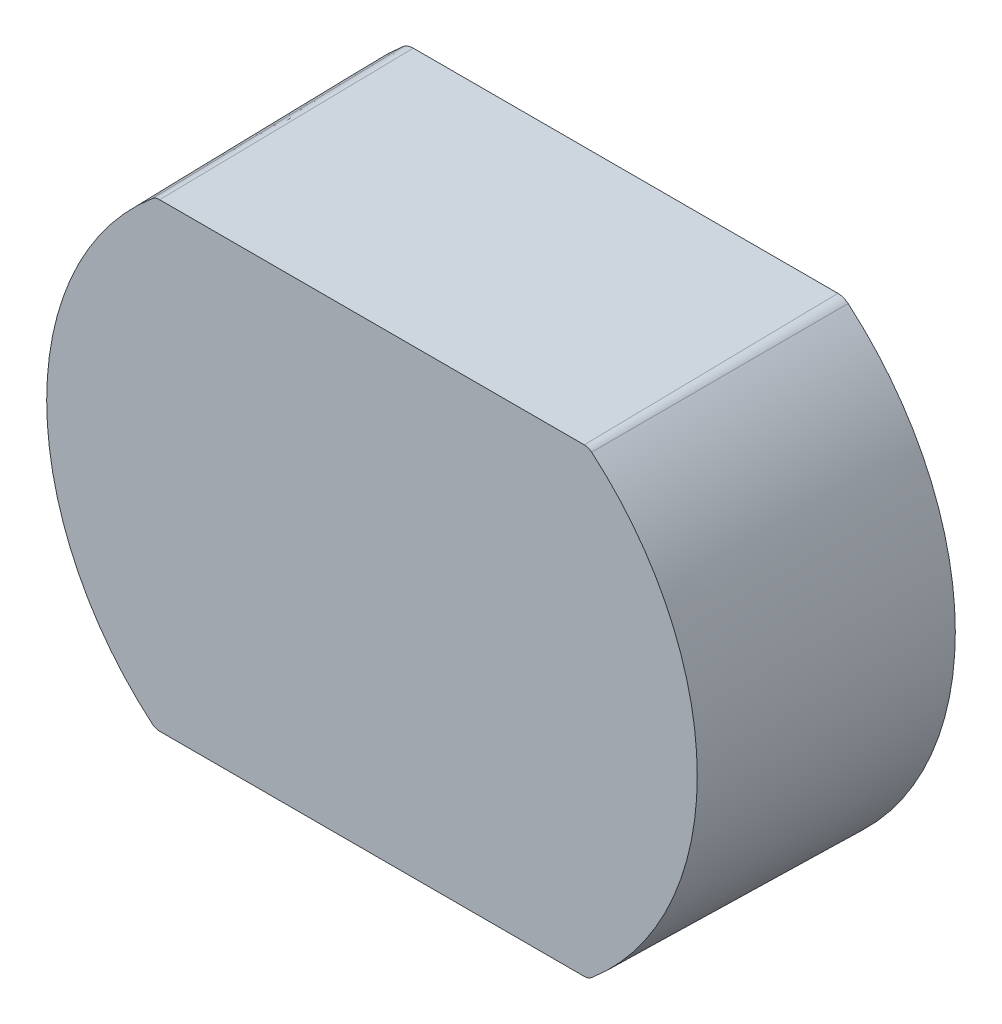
SolidWorks part; units mm, degrees
ref_plane "Płaszczyzna przednia" through (0, 0, 0) normal (0, 0, 1) x (1, 0, 0)
ref_plane "Płaszczyzna górna" through (0, 0, 0) normal (0, 1, 0) x (1, 0, 0)
ref_plane "Płaszczyzna prawa" through (0, 0, 0) normal (1, 0, 0) x (0, 0, -1)
sketch "Szkic1" plane through (0, 0, 0) normal (0, 0, 1) x (1, 0, 0)
  line L2 (-13.3938, -14.1) -> (13.3938, -14.1) construction
  line L4 (-20.1, 0) -> (20.1, 0) construction
  line L5 (-13.3938, 14.1) -> (13.3938, 14.1) construction
  line L6 (-13.3938, -14.8) -> (13.3938, -14.8)
  line L7 (-13.3938, 14.8) -> (13.3938, 14.8)
  arc A1 (-13.5873, 14.0292) -> (-13.5873, -14.0292) centre (-1.7333, 0) ccw construction
  arc A2 (-13.5873, -14.0292) -> (-13.3938, -14.1) centre (-13.3938, -13.8002) ccw construction
  arc A3 (13.3938, -14.1) -> (13.5873, -14.0292) centre (13.3938, -13.8002) ccw construction
  arc A4 (13.5873, -14.0292) -> (13.5873, 14.0292) centre (1.7333, 0) ccw construction
  arc A6 (13.3938, 14.1) -> (13.5873, 14.0292) centre (13.3938, 13.8002) cw construction
  arc A7 (-13.5873, 14.0292) -> (-13.3938, 14.1) centre (-13.3938, 13.8002) cw construction
  arc A8 (-14.0391, 14.5639) -> (-14.0391, -14.5639) centre (-1.7333, 0) ccw
  arc A9 (-14.0391, -14.5639) -> (-13.3938, -14.8) centre (-13.3938, -13.8002) ccw
  arc A10 (13.3938, -14.8) -> (14.0391, -14.5639) centre (13.3938, -13.8002) ccw
  arc A11 (14.0391, -14.5639) -> (14.0391, 14.5639) centre (1.7333, 0) ccw
  arc A12 (13.3938, 14.8) -> (14.0391, 14.5639) centre (13.3938, 13.8002) cw
  arc A13 (-14.0391, 14.5639) -> (-13.3938, 14.8) centre (-13.3938, 13.8002) cw
  dimension "D1" = 0.7
extrude "Dodanie-wyciągnięcie1" add sketch "Szkic1" along normal blind 16 draft 1
